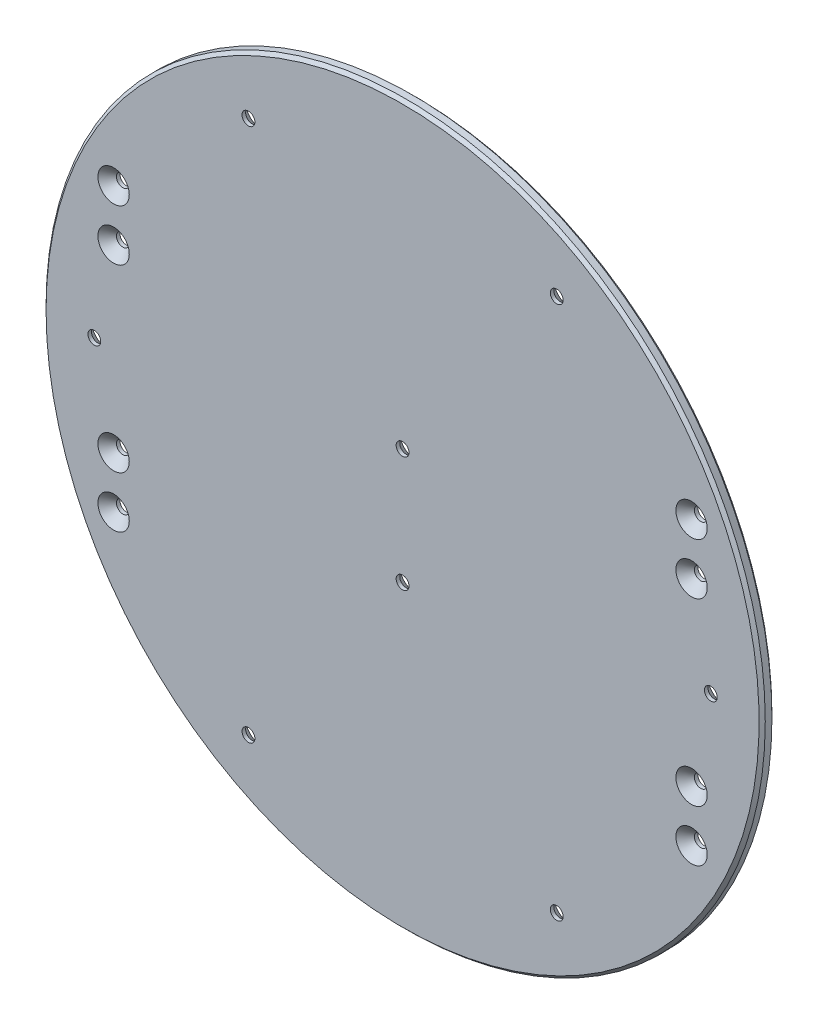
SolidWorks part; units mm, degrees
ref_plane "Front" through (0, 0, 0) normal (0, 0, 1) x (1, 0, 0)
ref_plane "Top" through (0, 0, 0) normal (0, 1, 0) x (1, 0, 0)
ref_plane "Right" through (0, 0, 0) normal (1, 0, 0) x (0, 0, -1)
sketch "Sketch1" plane through (0, 0, 0) normal (0, 0, 1) x (1, 0, 0)
  line L0 (0, 81.3381) -> (0, -84.128) construction
  line L1 (-98.6144, 0) -> (97.7559, 0) construction
  circle A0 centre (0, 0) radius 88.9
  dimension "D1" = 177.8
extrude "Base-Extrude" add sketch "Sketch1" along normal blind 3.175
sketch "Sketch2" plane through (0, 0, 3.175) normal (0, 0, 1) x (1, 0, 0)
  line L0 (-71.4375, 68.1429) -> (-71.4375, -88.5662) construction
  line L1 (71.4375, 73.6415) -> (71.4375, -92.1009) construction
  line L2 (-99.2687, 38.1) -> (100.447, 38.1) construction
  line L3 (-102.6071, -38.1) -> (76.489, -38.1) construction
  line L4 (-71.5795, 34.925) -> (82.773, 34.925) construction
  line L5 (-71.5795, 22.225) -> (82.773, 22.225) construction
  line L6 (-71.5795, -22.225) -> (76.489, -22.225) construction
  line L7 (-75.3107, -34.925) -> (72.365, -34.925) construction
  circle A0 centre (71.4375, 34.925) radius 1.5875
  circle A1 centre (71.4375, 22.225) radius 1.5875
  circle A2 centre (71.4375, -22.225) radius 1.5875
  circle A3 centre (71.4375, -34.925) radius 1.5875
  circle A4 centre (-71.4375, -22.225) radius 1.5875
  circle A5 centre (-71.4375, -34.925) radius 1.5875
  circle A6 centre (-71.4375, 34.925) radius 1.5875
  circle A7 centre (-71.4375, 22.225) radius 1.5875
  dimension "D9" = 3.175
  dimension "D10" = 3.175
  dimension "D11" = 3.175
  dimension "D12" = 3.175
  dimension "D13" = 3.175
  dimension "D14" = 3.175
  dimension "D15" = 3.175
  dimension "D16" = 3.175
  dimension "D1" = 142.875
  dimension "D2" = 71.4375
  dimension "D3" = 76.2
  dimension "D4" = 38.1
  dimension "D5" = 12.7
  dimension "D6" = 12.7
  dimension "D7" = 3.175
  dimension "D8" = 3.175
extrude "RAIL HOLES" cut sketch "Sketch2" against normal blind 3.175
sketch "Sketch3" plane through (0, 0, 3.175) normal (0, 0, 1) x (1, 0, 0)
  line L0 (0, 30.6349) -> (0, -36.5262) construction
  circle A0 centre (0, 14.2875) radius 1.5875
  circle A1 centre (0, -14.2875) radius 1.5875
  dimension "D1" = 28.575
  dimension "D2" = 3.175
  dimension "D3" = 3.175
  dimension "D4" = 14.2875
extrude "SHOCK MT HOLES" cut sketch "Sketch3" against normal through all
sketch "Sketch4" plane through (0, 0, 3.175) normal (0, 0, 1) x (1, 0, 0)
  line L0 (0, 93.4756) -> (0, -89.9408) construction
  line L1 (-107.7129, 0) -> (109.6767, 0) construction
  circle A0 centre (0, 0) radius 76.2 construction
  circle A1 centre (76.2, 0) radius 1.5875
  circle A2 centre (65.9911, -38.1) radius 1.5875
  circle A3 centre (0, 0) radius 76.2 construction
  circle A4 centre (-65.9911, -38.1) radius 1.5875
  circle A5 centre (0, 0) radius 76.2 construction
  circle A6 centre (0, 76.2) radius 1.5875
  circle A7 centre (0, 0) radius 76.2 construction
  circle A8 centre (-65.9911, 38.1) radius 1.5875
  circle A9 centre (0, 0) radius 76.2 construction
  circle A10 centre (0, -76.2) radius 1.5875
  circle A11 centre (0, 0) radius 76.2 construction
  circle A12 centre (65.9911, 38.1) radius 1.5875
  circle A13 centre (0, 0) radius 76.2 construction
  circle A14 centre (38.1, -65.9911) radius 1.5875
  circle A15 centre (0, 0) radius 76.2 construction
  circle A16 centre (-38.1, -65.9911) radius 1.5875
  circle A17 centre (0, 0) radius 76.2 construction
  circle A18 centre (-76.2, 0) radius 1.5875
  circle A19 centre (0, 0) radius 76.2 construction
  circle A20 centre (-38.1, 65.9911) radius 1.5875
  circle A21 centre (0, 0) radius 76.2 construction
  circle A22 centre (38.1, 65.9911) radius 1.5875
  dimension "D1" = 152.4
  dimension "D2" = 3.175
extrude "Cut-Extrude2" cut sketch "Sketch4" against normal through all
chamfer "rails" distance 2.286 angle 45
chamfer "shock and ring" distance 2.286 angle 45
chamfer "edge" distance 0.762 angle 45
